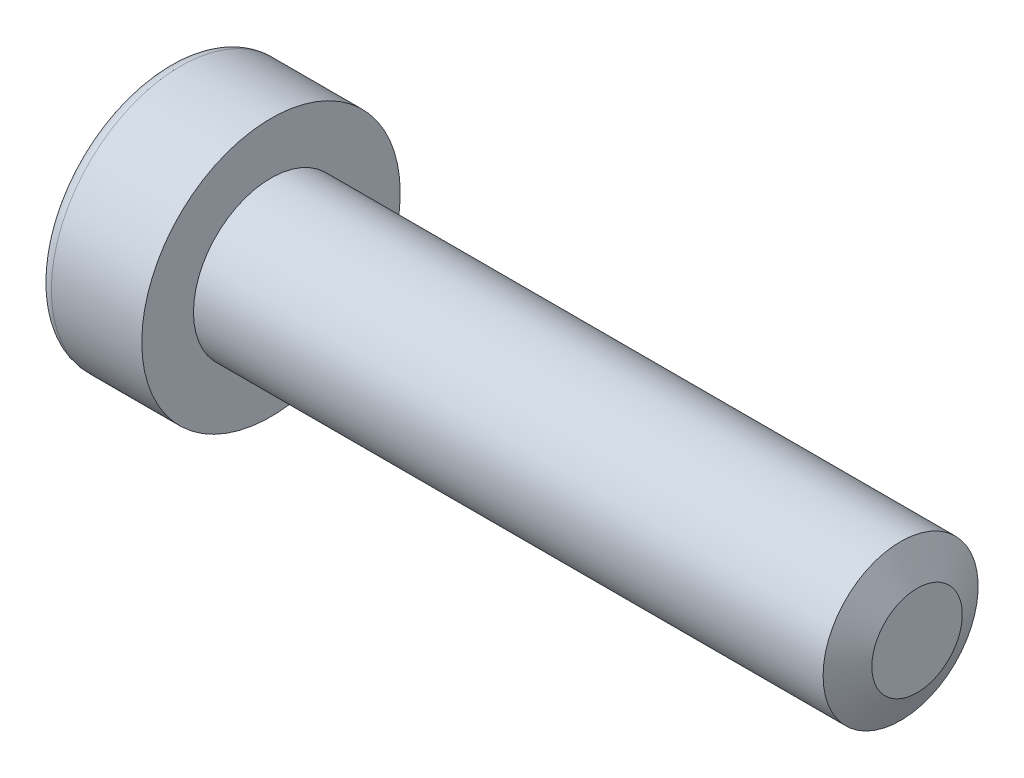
SolidWorks part; units mm, degrees
ref_plane "Ebene vorne" through (0, 0, 0) normal (0, 0, 1) x (1, 0, 0)
ref_plane "Ebene oben" through (0, 0, 0) normal (0, 1, 0) x (1, 0, 0)
ref_plane "Ebene rechts" through (0, 0, 0) normal (1, 0, 0) x (0, 0, -1)
sketch "Skizze1" plane through (0, 0, 0) normal (0, 0, 1) x (1, 0, 0)
  line L0 (-65.0118, 0) -> (64.6036, 0) construction
  line L1 (-29, 0) -> (-29, 5)
  line L2 (-29, 5) -> (-25, 5)
  line L3 (-25, 5) -> (-25, 3)
  line L4 (-25, 3) -> (0, 3)
  line L5 (0, 3) -> (0, 0)
  line L6 (0, 0) -> (-29, 0)
  dimension "D1" = 6
  dimension "D2" = 25
  dimension "D3" = 10
  dimension "D4" = 4
revolve "Rotation1" add sketch "Skizze1" angle 360 about L0
fillet "Verrundung1" radius 0.5 1 edges at (-29, 0, 5)
sketch "Skizze2" plane through (-29, 0, 0) normal (-1, 0, 0) x (0, 0, 1)
  line L1 (2, 1.1547) -> (0, 2.3094)
  line L2 (0, 2.3094) -> (-2, 1.1547)
  line L3 (-2, 1.1547) -> (-2, -1.1547)
  line L4 (-2, -1.1547) -> (0, -2.3094)
  line L5 (0, -2.3094) -> (2, -1.1547)
  line L6 (2, -1.1547) -> (2, 1.1547)
  circle A0 centre (0, 0) radius 2 construction
  dimension "D1" = 4
extrude "Schnitt-Linear austragen1" cut sketch "Skizze2" against normal blind 3
chamfer "Fase1" distance 1.25 angle 27 1 edges at (0, 0, 3)
